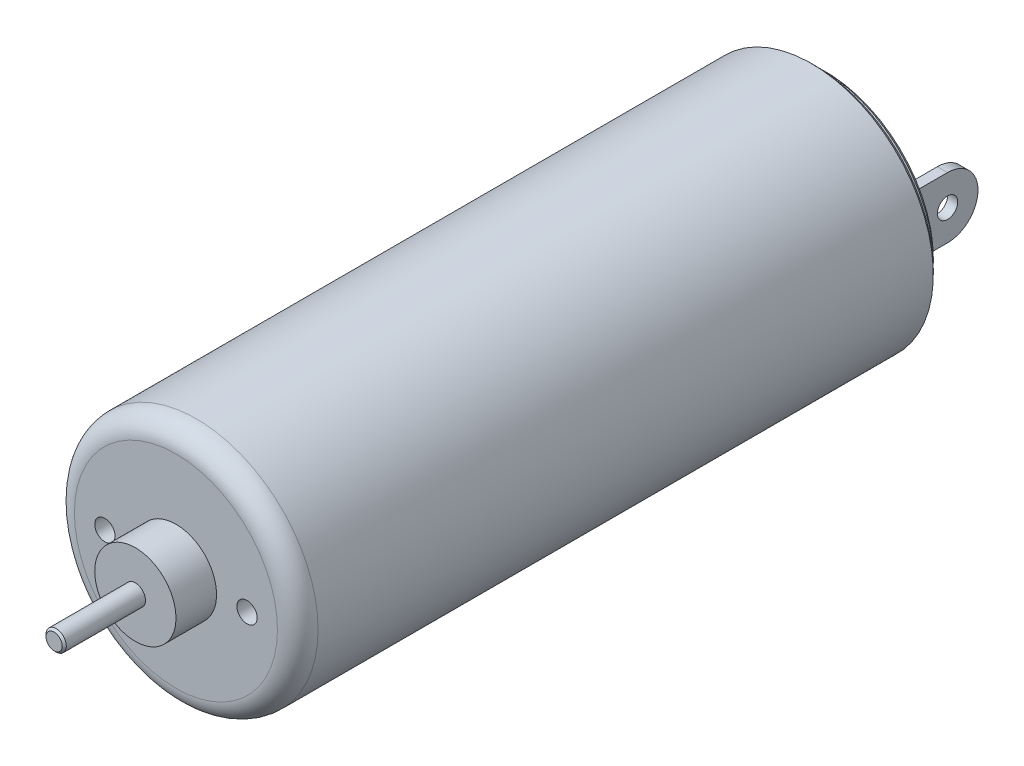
SolidWorks part; units mm, degrees
ref_plane "Plan de face" through (0, 0, 0) normal (0, 0, 1) x (1, 0, 0)
ref_plane "Plan de dessus" through (0, 0, 0) normal (0, 1, 0) x (1, 0, 0)
ref_plane "Plan de droite" through (0, 0, 0) normal (1, 0, 0) x (0, 0, -1)
sketch "Esquisse1" plane through (0, 0, 0) normal (1, 0, 0) x (0, 0, -1)
  line L0 (-19, 0) -> (-19, 0.5)
  line L1 (-15, 2) -> (-13, 2)
  line L2 (-19, 0.5) -> (-15, 0.5)
  line L3 (-19, 0) -> (19, 0)
  line L4 (-15, 0.5) -> (-15, 2)
  line L5 (-13, 2) -> (-13, 6)
  line L6 (-13, 6) -> (18.5, 6)
  line L7 (18.5, 6) -> (18.5, 5.5)
  line L8 (18.5, 5.5) -> (19, 5.5)
  line L9 (19, 5.5) -> (19, 0)
  line L10 (26.4443, 0) -> (-30.2761, 0) construction
  dimension "D1" = 32
  dimension "D2" = 1
  dimension "D3" = 4
  dimension "D4" = 4
  dimension "D5" = 2
  dimension "D6" = 0.5
  dimension "D7" = 12
  dimension "D8" = 11
revolve "Révolution1" add sketch "Esquisse1" angle 360 about L10
fillet "Congé1" radius 1 1 edges at (-6, 0, 13)
sketch "Esquisse2" plane through (0, 0, -19) normal (0, 0, -1) x (-1, 0, 0)
  circle A0 centre (0, 0) radius 0.5
  dimension "D1" = 1
extrude "Enlèv. mat.-Extru.1" cut sketch "Esquisse2" against normal blind 1
chamfer "Chanfrein1" distance 0.2 angle 45 3 edges at (-0.5, 0, -19) (-5.5, 0, -19) (-6, 0, -18.5)
chamfer "Chanfrein2" distance 0.1 angle 45 1 edges at (-0.5, 0, 19)
sketch "Esquisse3" plane through (0, 0, 13) normal (0, 0, 1) x (1, 0, 0)
  circle A0 centre (-3.5, 0) radius 0.5
  circle A1 centre (3.5, 0) radius 0.5
  dimension "D1" = 1
  dimension "D2" = 1
  dimension "D3" = 3.5
  dimension "D4" = 3.5
extrude "Enlèv. mat.-Extru.2" cut sketch "Esquisse3" against normal blind 2
sketch "Esquisse4" plane through (0, 0, -19) normal (0, 0, -1) x (-1, 0, 0)
  line L1 (-3.5, 1.5) -> (-3, 1.5)
  line L2 (-3.5, 1.5) -> (-3.5, -1.5)
  line L3 (-3.5, -1.5) -> (-3, -1.5)
  line L4 (-3, 1.5) -> (-3, -1.5)
  dimension "D1" = 0.5
  dimension "D2" = 3
  dimension "D3" = 1.5
  dimension "D4" = 3
extrude "Extrusion1" add sketch "Esquisse4" along normal blind 4
sketch "Esquisse5" plane through (3.5, 0, 0) normal (1, 0, 0) x (0, 0, -1)
  line L0 (23, -1.5) -> (19, -1.5) construction
  line L1 (23, 1.5) -> (23, -1.5) construction
  circle A0 centre (21.5, 0) radius 0.5
  dimension "D1" = 1
  dimension "D3" = 1.5
  dimension "D2" = 1.5
extrude "Enlèv. mat.-Extru.3" cut sketch "Esquisse5" against normal blind 4
fillet "Congé2" radius 1.5 2 edges at (3.25, 1.5, -23) (3.25, -1.5, -23)
mirror "Symétrie2" about plane through (0, 0, 0) normal (1, 0, 0) of "Extrusion1", "Congé2", "Enlèv. mat.-Extru.3"
